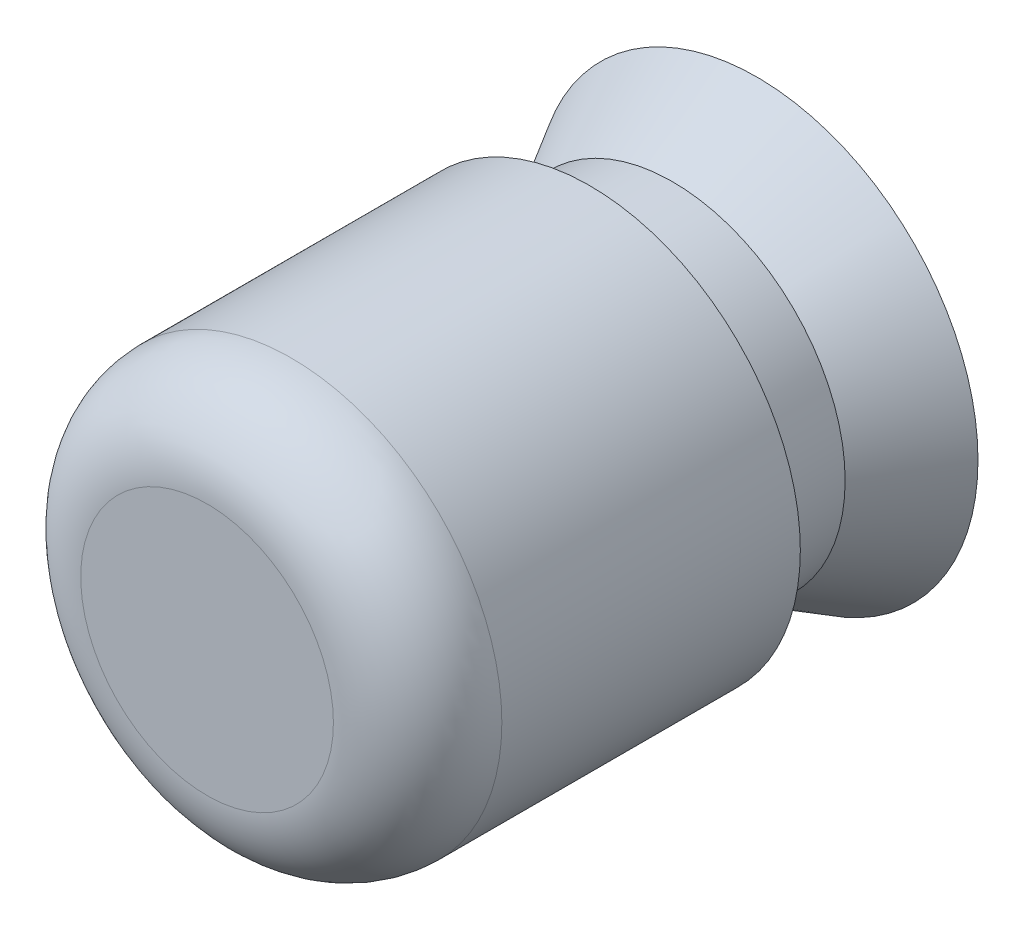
SolidWorks part; units mm, degrees
ref_plane "Спереди" through (0, 0, 0) normal (0, 0, 1) x (1, 0, 0)
ref_plane "Сверху" through (0, 0, 0) normal (0, 1, 0) x (1, 0, 0)
ref_plane "Справа" through (0, 0, 0) normal (1, 0, 0) x (0, 0, -1)
sketch "Эскиз1" plane through (0, 0, 0) normal (1, 0, 0) x (0, 0, -1)
  line L0 (0, 0) -> (23.9108, 0) construction
  line L1 (0, 0) -> (0, 1.1906)
  line L2 (0.7938, 1.9844) -> (3.6068, 1.9844)
  line L3 (3.6068, 1.9844) -> (3.6068, 1.6256)
  line L4 (3.6068, 1.6256) -> (4.3878, 1.6256)
  line L5 (4.3878, 1.6256) -> (5.1816, 2.0839)
  line L6 (5.1816, 2.0839) -> (5.1816, 0)
  line L7 (5.1816, 0) -> (0, 0)
  arc A0 (0, 1.1906) -> (0.7938, 1.9844) centre (0.7937, 1.1906) cw
  dimension "D7" = 0.7937
  dimension "D1" = 30
  dimension "D2" = 0.7937
  dimension "D3" = 1.5748
  dimension "D4" = 3.6068
  dimension "D5" = 3.9688
  dimension "D6" = 3.2512
revolve "Повернуть1" add sketch "Эскиз1" angle 360 about L0
